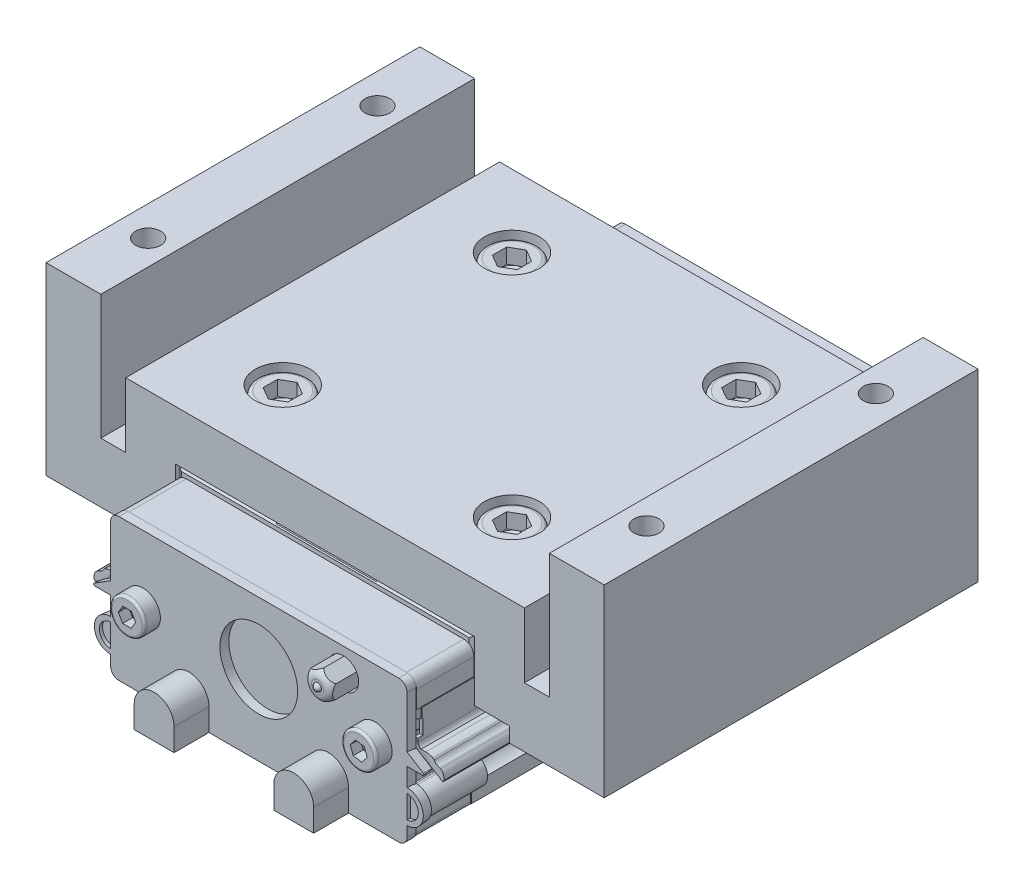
SolidWorks part; units mm, degrees
other "KKR86-FS-P_W-1-solid4"
other "KKR86-FS-P_W-1-solid6"
other "KKR86-FS-P_W-1-solid8"
other "KKR86-FS-P_W-1-solid15"
other "GB∕T70.1-M6×12（内六角圆柱头螺钉）-4-solid1"
other "KKR86-FS-P_W-1-solid3"
other "KKR86-FS-P_W-1-solid5"
other "KKR86-FS-P_W-1-solid13"
other "KKR86-FS-P_W-1-solid7"
other "GB∕T70.1-M6×12（内六角圆柱头螺钉）-3-solid1"
other "KKR86-FS-P_W-1-solid17"
other "KKR86-FS-P_W-1-solid10"
other "KKR86-FS-P_W-1-solid9"
other "KKR86-FS-P_W-1-solid12"
other "KKR86-FS-P_W-1-solid1"
other "KKR86-FS-P_W-1-solid2"
other "GB∕T70.1-M6×12（内六角圆柱头螺钉）-1-solid1"
other "KKR86-FS-P_W-1-solid11"
other "KKR86-FS-P_W-1-solid14"
other "GB∕T70.1-M6×12（内六角圆柱头螺钉）-2-solid1"
other "KKR86-FS-Z-P-1-solid1"
other "KKR86-FS-P_W-1-solid16"
ref_plane "前视基准面" through (0, 0, 0) normal (0, 0, 1) x (1, 0, 0)
ref_plane "上视基准面" through (0, 0, 0) normal (0, 1, 0) x (1, 0, 0)
ref_plane "右视基准面" through (0, 0, 0) normal (1, 0, 0) x (0, 0, -1)
imported_body "输入1"
imported_body "输入2"
imported_body "输入3"
imported_body "输入5"
imported_body "输入6"
imported_body "输入7"
imported_body "输入8"
imported_body "输入9"
imported_body "输入10"
imported_body "输入11"
imported_body "输入12"
imported_body "输入13"
imported_body "输入14"
imported_body "输入15"
imported_body "输入16"
imported_body "输入17"
imported_body "输入18"
imported_body "输入19"
imported_body "输入21"
imported_body "输入22"
imported_body "输入23"
imported_body "输入25"
sketch "草图1" plane through (29.85, 0, 0) normal (1, 0, 0) x (0, 0, -1)
  line L0 (-820.2, 10.5) -> (-831.7032, 10.5) construction
  line L1 (-829.6615, 10.5) -> (-823.6106, 10.5)
  line L2 (-829.6615, 10.5) -> (-829.6615, 7)
  line L3 (-829.6615, 7) -> (-823.6106, 7)
  line L4 (-823.6106, 10.5) -> (-823.6106, 7)
  line L5 (-820.2, 7) -> (-831.7032, 7) construction
extrude "切除-拉伸1" cut sketch "草图1" along normal blind 10
sketch "草图2" plane through (-29.85, 0, 0) normal (-1, 0, 0) x (0, 0, 1)
  line L0 (918.2, 10.5) -> (906.6968, 10.5) construction
  line L1 (909.2909, 10.5) -> (914.4236, 10.5)
  line L2 (909.2909, 10.5) -> (909.2909, 7.4947)
  line L3 (909.2909, 7.4947) -> (914.4236, 7.4947)
  line L4 (914.4236, 10.5) -> (914.4236, 7.4947)
extrude "切除-拉伸2" cut sketch "草图2" along normal blind 10
